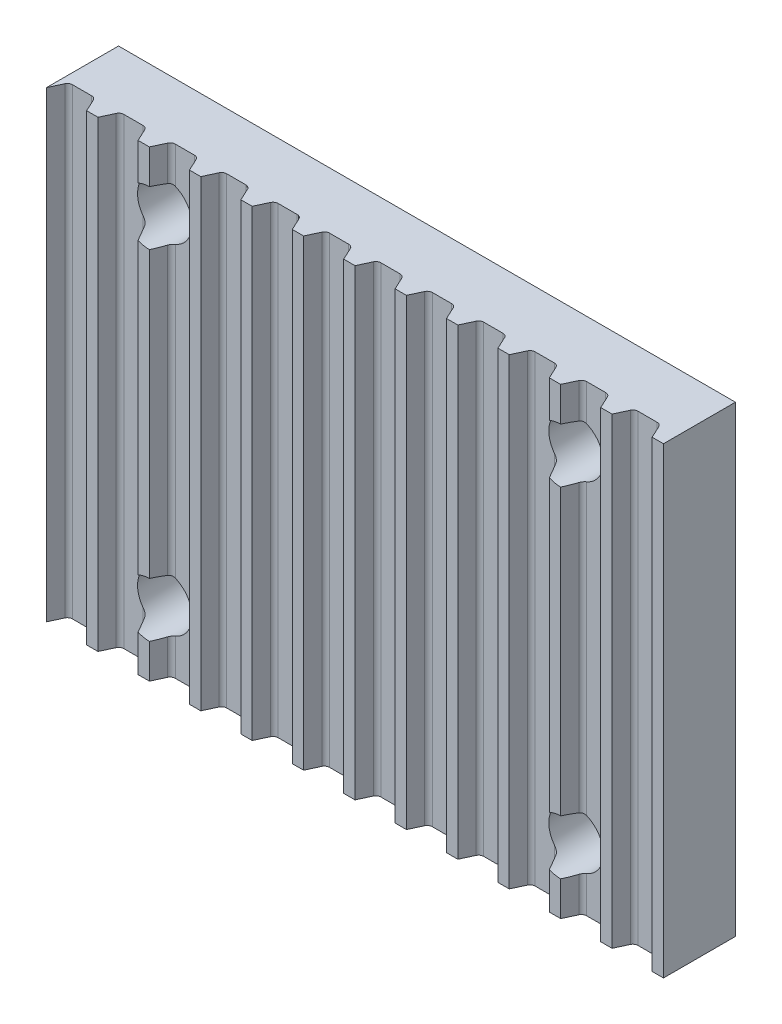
SolidWorks part; units mm, degrees
ref_plane "Plan de face" through (0, 0, 0) normal (0, 0, 1) x (1, 0, 0)
ref_plane "Plan de dessus" through (0, 0, 0) normal (0, 1, 0) x (1, 0, 0)
ref_plane "Plan de droite" through (0, 0, 0) normal (1, 0, 0) x (0, 0, -1)
sketch "Esquisse1" plane through (0, 0, 0) normal (0, 0, 1) x (1, 0, 0)
  line L1 (0, 0) -> (60, 0)
  line L2 (0, 0) -> (0, 45)
  line L3 (0, 45) -> (60, 45)
  line L4 (60, 0) -> (60, 45)
  dimension "D1" = 45
  dimension "D2" = 60
extrude "Boss.-Extru.1" add sketch "Esquisse1" along normal blind 7
sketch "Esquisse3" plane through (0, 45, 65) normal (0, 1, 0) x (1, 0, 0)
  line L0 (0, 65) -> (0.6995, 66.5)
  line L1 (0.6995, 66.5) -> (3.1995, 66.5)
  line L2 (3.1995, 66.5) -> (3.8989, 65)
  line L3 (5, 65) -> (5.6995, 66.5) construction
  line L4 (0, 65) -> (3.8989, 65)
  line L5 (1.9495, 66.5) -> (1.9495, 65) construction
  line L6 (5.6995, 66.5) -> (8.1995, 66.5) construction
  line L7 (60, 65) -> (0, 65) construction
  line L12 (8.1995, 66.5) -> (8.8989, 65) construction
  line L13 (5, 65) -> (8.8989, 65) construction
  line L14 (6.9495, 66.5) -> (6.9495, 65) construction
  dimension "D1" = 50
  dimension "D2" = 1.5
  dimension "D3" = 50
  dimension "D4" = 1.5
  dimension "D5" = 5
  dimension "D6" = 2.5
sketch "Esquisse6" plane through (0, 0, 7) normal (0, 0, 1) x (1, 0, 0)
  line L0 (60, 0) -> (60, 45) construction
  line L1 (0, 0) -> (60, 0) construction
  line L2 (0, 45) -> (0, 0) construction
  line L3 (60, 45) -> (0, 45) construction
  circle A0 centre (50, 6) radius 2.65
  circle A1 centre (10, 6) radius 2.65
  circle A2 centre (10, 39) radius 2.65
  circle A3 centre (50, 39) radius 2.65
  point P14 (0, 0)
  point P15 (0, 0)
  point P18 (0, 0)
  dimension "D1" = 5.3
  dimension "D2" = 10
  dimension "D5" = 10
  dimension "D4" = 6
  dimension "D3" = 6
extrude "Enlèv. mat.-Extru.1" cut sketch "Esquisse6" against normal blind 45
other "Empreinte1"
other "connectingplateAT5<1>@Assemblage_moule_plate1"
sketch "Esquisse7" plane through (0, 0, 0) normal (0, -1, 0) x (1, 0, 0)
  line L0 (60, 7) -> (58.8989, 7)
  line L1 (58.8989, 7) -> (58.3341, 5.7887)
  line L2 (57.8809, 5.5) -> (56.018, 5.5)
  line L3 (55.5648, 5.7887) -> (55, 7)
  line L4 (55, 7) -> (53.8989, 7)
  arc A0 (58.3341, 5.7887) -> (57.8809, 5.5) centre (57.8809, 6) cw
  arc A1 (56.018, 5.5) -> (55.5648, 5.7887) centre (56.018, 6) cw
  point P14 (0, 0)
